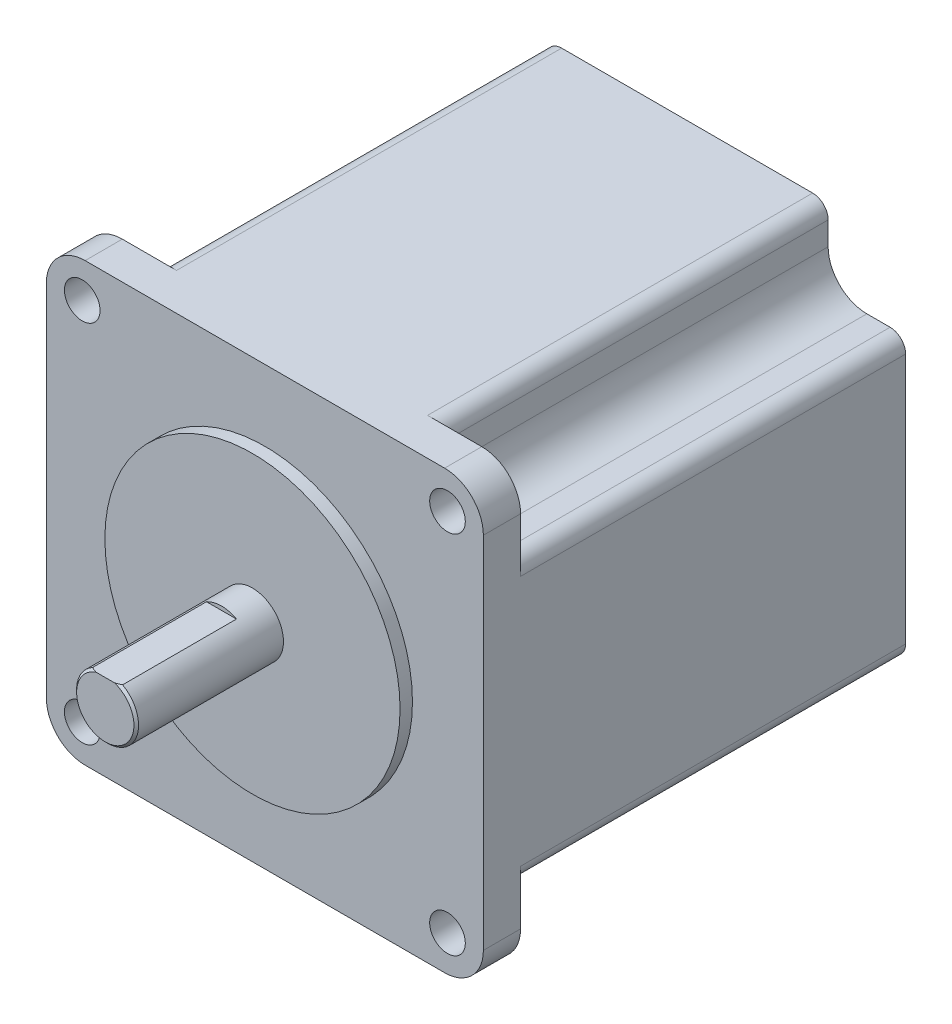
SolidWorks part; units mm, degrees
ref_plane "前视基准面" through (0, 0, 0) normal (0, 0, 1) x (1, 0, 0)
ref_plane "上视基准面" through (0, 0, 0) normal (0, 1, 0) x (1, 0, 0)
ref_plane "右视基准面" through (0, 0, 0) normal (1, 0, 0) x (0, 0, -1)
sketch "草图1" plane through (0, 0, 0) normal (0, 0, 1) x (1, 0, 0)
  circle A0 centre (0, 0) radius 19.05
extrude "凸台-拉伸1" add sketch "草图1" against normal blind 1.6
sketch "草图2" plane through (0, 0, 0) normal (0, 0, 1) x (1, 0, 0)
  circle A0 centre (0, 0) radius 4
extrude "凸台-拉伸2" add sketch "草图2" along normal blind 19
sketch "草图3" plane through (0, 0, 19) normal (0, 0, 1) x (1, 0, 0)
  line L2 (-1.9365, 3.5) -> (1.9365, 3.5)
  arc A2 (1.9365, 3.5) -> (-1.9365, 3.5) centre (0, 0) ccw
extrude "切除-拉伸1" cut sketch "草图3" against normal blind 15
sketch "草图4" plane through (0, 0, -1.6) normal (0, 0, -1) x (-1, 0, 0)
  line L1 (0, 28.2) -> (23.2, 28.2)
  line L2 (28.2, 23.2) -> (28.2, -23.2)
  line L3 (23.2, -28.2) -> (-23.2, -28.2)
  line L4 (-28.2, -23.2) -> (-28.2, 23.2)
  line L5 (-23.2, 28.2) -> (0, 28.2)
  arc A0 (-23.2, -28.2) -> (-28.2, -23.2) centre (-23.2, -23.2) cw
  arc A1 (28.2, -23.2) -> (23.2, -28.2) centre (23.2, -23.2) cw
  arc A2 (23.2, 28.2) -> (28.2, 23.2) centre (23.2, 23.2) cw
  arc A3 (-28.2, 23.2) -> (-23.2, 28.2) centre (-23.2, 23.2) cw
  dimension "D1" = 5
extrude "凸台-拉伸3" add sketch "草图4" along normal blind 54.5
sketch "草图5" plane through (0, 0, -56.1) normal (0, 0, -1) x (-1, 0, 0)
  line L1 (23.2, 28.2) -> (-23.2, 28.2) construction
  line L2 (11.4944, 28.2) -> (16.2, 28.2)
  line L3 (18.2, 26.2) -> (18.2, 23.2)
  line L4 (23.2, 18.2) -> (26.2, 18.2)
  line L5 (28.2, -23.2) -> (28.2, 23.2) construction
  line L6 (28.2, 16.2) -> (28.2, 9.9204)
  line L7 (28.2, 9.9204) -> (36.4601, 9.9204)
  line L8 (36.4601, 9.9204) -> (36.4601, 32.1771)
  line L9 (36.4601, 32.1771) -> (11.4944, 32.1771)
  line L10 (11.4944, 32.1771) -> (11.4944, 28.2)
  line L12 (-11.4944, 32.1771) -> (-11.4944, 28.2)
  line L13 (-36.4601, 32.1771) -> (-11.4944, 32.1771)
  line L14 (-36.4601, 9.9204) -> (-36.4601, 32.1771)
  line L15 (-28.2, 9.9204) -> (-36.4601, 9.9204)
  line L16 (-28.2, 16.2) -> (-28.2, 9.9204)
  line L17 (-23.2, 18.2) -> (-26.2, 18.2)
  line L18 (-18.2, 26.2) -> (-18.2, 23.2)
  line L19 (-11.4944, 28.2) -> (-16.2, 28.2)
  line L20 (11.4944, -32.1771) -> (11.4944, -28.2)
  line L21 (36.4601, -32.1771) -> (11.4944, -32.1771)
  line L22 (36.4601, -9.9204) -> (36.4601, -32.1771)
  line L23 (28.2, -9.9204) -> (36.4601, -9.9204)
  line L24 (28.2, -16.2) -> (28.2, -9.9204)
  line L25 (23.2, -18.2) -> (26.2, -18.2)
  line L26 (18.2, -26.2) -> (18.2, -23.2)
  line L27 (11.4944, -28.2) -> (16.2, -28.2)
  line L28 (-11.4944, -28.2) -> (-16.2, -28.2)
  line L29 (-18.2, -26.2) -> (-18.2, -23.2)
  line L30 (-23.2, -18.2) -> (-26.2, -18.2)
  line L31 (-28.2, -16.2) -> (-28.2, -9.9204)
  line L32 (-28.2, -9.9204) -> (-36.4601, -9.9204)
  line L33 (-36.4601, -9.9204) -> (-36.4601, -32.1771)
  line L34 (-36.4601, -32.1771) -> (-11.4944, -32.1771)
  line L35 (-11.4944, -32.1771) -> (-11.4944, -28.2)
  arc A0 (18.2, 23.2) -> (23.2, 18.2) centre (23.2, 23.2) ccw
  arc A1 (26.2, 18.2) -> (28.2, 16.2) centre (26.2, 16.2) cw
  arc A2 (16.2, 28.2) -> (18.2, 26.2) centre (16.2, 26.2) cw
  arc A3 (-16.2, 28.2) -> (-18.2, 26.2) centre (-16.2, 26.2) ccw
  arc A4 (-26.2, 18.2) -> (-28.2, 16.2) centre (-26.2, 16.2) ccw
  arc A5 (-18.2, 23.2) -> (-23.2, 18.2) centre (-23.2, 23.2) cw
  arc A6 (16.2, -28.2) -> (18.2, -26.2) centre (16.2, -26.2) ccw
  arc A7 (26.2, -18.2) -> (28.2, -16.2) centre (26.2, -16.2) ccw
  arc A8 (18.2, -23.2) -> (23.2, -18.2) centre (23.2, -23.2) cw
  arc A9 (-18.2, -23.2) -> (-23.2, -18.2) centre (-23.2, -23.2) ccw
  arc A10 (-26.2, -18.2) -> (-28.2, -16.2) centre (-26.2, -16.2) cw
  arc A11 (-16.2, -28.2) -> (-18.2, -26.2) centre (-16.2, -26.2) cw
  point P20 (28.2, 18.2)
  point P23 (18.2, 28.2)
  point P38 (-18.2, 28.2)
  point P39 (-28.2, 18.2)
  point P54 (18.2, -28.2)
  point P55 (28.2, -18.2)
  point P70 (-28.2, -18.2)
  point P71 (-18.2, -28.2)
  dimension "D1" = 5
  dimension "D2" = 2
extrude "切除-拉伸2" cut sketch "草图5" against normal blind 49.7
sketch "草图6" plane through (0, 0, -1.6) normal (0, 0, 1) x (1, 0, 0)
  circle A0 centre (-23.57, 23.57) radius 2.3
  circle A1 centre (23.57, 23.57) radius 2.3
  circle A2 centre (23.57, -23.57) radius 2.3
  circle A3 centre (-23.57, -23.57) radius 2.3
extrude "切除-拉伸3" cut sketch "草图6" against normal blind 49.7
chamfer "倒角1" distance 0.3 angle 45 1 edges at (0, -4, 19)
